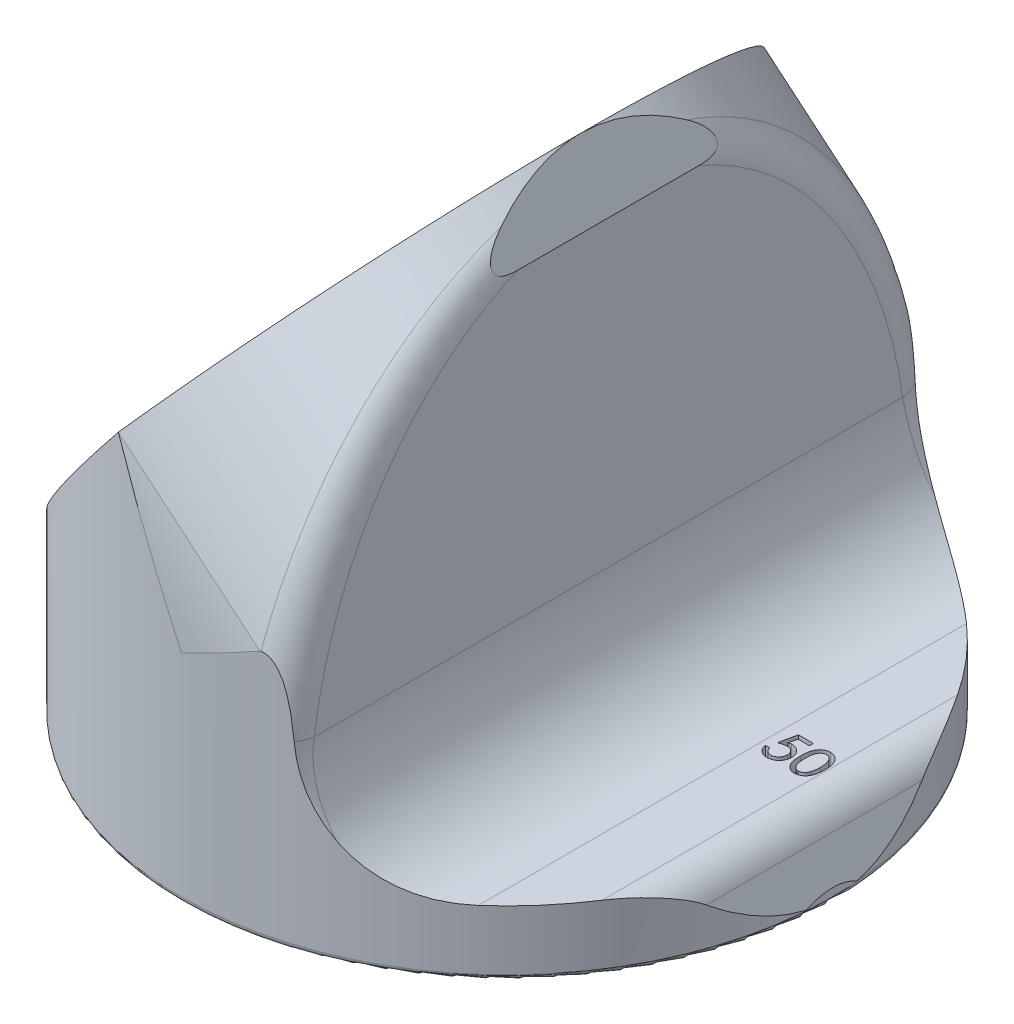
SolidWorks part; units mm, degrees
ref_plane "Front Plane" through (0, 0, 0) normal (0, 0, 1) x (1, 0, 0)
ref_plane "Top Plane" through (0, 0, 0) normal (0, 1, 0) x (1, 0, 0)
ref_plane "Right Plane" through (0, 0, 0) normal (1, 0, 0) x (0, 0, -1)
sketch "Sketch1" plane through (0, 0, 0) normal (0, 1, 0) x (1, 0, 0)
  circle A0 centre (0, 0) radius 30
extrude "Boss-Extrude1" add sketch "Sketch1" along normal blind 50
sketch "Sketch3" plane through (0, 50, 0) normal (0, 1, 0) x (1, 0, 0)
sketch "Sketch4" plane through (0, 0, 0) normal (0, -1, 0) x (-1, 0, 0)
  line L0 (0, 0) -> (-10, 0) construction
  line L1 (0, 0) -> (0, -10) construction
  line L2 (0, 0) -> (0, 10) construction
  line L3 (0, 0) -> (10, 0) construction
  line L5 (-2.5, 2.5) -> (2.5, 2.5)
  line L6 (-2.5, 2.5) -> (-2.5, -2.5)
  line L7 (-2.5, -2.5) -> (2.5, -2.5)
  line L8 (2.5, 2.5) -> (2.5, -2.5)
  line L9 (-2.5, 2.5) -> (2.5, -2.5) construction
  line L10 (-2.5, -2.5) -> (2.5, 2.5) construction
  line L11 (-2.5, -7.5) -> (2.5, -7.5)
  line L12 (-2.5, -7.5) -> (-2.5, -12.5)
  line L13 (-2.5, -12.5) -> (2.5, -12.5)
  line L14 (2.5, -7.5) -> (2.5, -12.5)
  line L15 (-2.5, -7.5) -> (2.5, -12.5) construction
  line L16 (-2.5, -12.5) -> (2.5, -7.5) construction
  line L17 (7.5, 2.5) -> (12.5, 2.5)
  line L18 (7.5, 2.5) -> (7.5, -2.5)
  line L19 (7.5, -2.5) -> (12.5, -2.5)
  line L20 (12.5, 2.5) -> (12.5, -2.5)
  line L21 (7.5, 2.5) -> (12.5, -2.5) construction
  line L22 (7.5, -2.5) -> (12.5, 2.5) construction
  line L23 (-12.5, 2.5) -> (-7.5, 2.5)
  line L24 (-12.5, 2.5) -> (-12.5, -2.5)
  line L25 (-12.5, -2.5) -> (-7.5, -2.5)
  line L26 (-7.5, 2.5) -> (-7.5, -2.5)
  line L27 (-12.5, 2.5) -> (-7.5, -2.5) construction
  line L28 (-12.5, -2.5) -> (-7.5, 2.5) construction
  line L29 (2.5, 7.5) -> (-2.5, 7.5)
  line L30 (2.5, 7.5) -> (2.5, 12.5)
  line L31 (2.5, 12.5) -> (-2.5, 12.5)
  line L32 (-2.5, 7.5) -> (-2.5, 12.5)
  line L33 (2.5, 7.5) -> (-2.5, 12.5) construction
  line L34 (2.5, 12.5) -> (-2.5, 7.5) construction
  dimension "D1" = 5
  dimension "D2" = 5
  dimension "D3" = 5
  dimension "D4" = 5
  dimension "D5" = 5
  dimension "D6" = 5
extrude "Cut-Extrude2" cut sketch "Sketch4" against normal blind 3
fillet "Fillet2" radius 0.5 21 edges at (0, 0, 30) (2.5, 0, 0) (0, 0, 2.5) (-2.5, 0, 0) (0, 0, -2.5) (2.5, 0, 10) (0, 0, 12.5) (-2.5, 0, 10) (0, 0, 7.5) (-7.5, 0, 0) (-10, 0, 2.5) (-12.5, 0, 0) (-10, 0, -2.5) (12.5, 0, 0) (10, 0, 2.5) (7.5, 0, 0) (10, 0, -2.5) (-2.5, 0, -10) (0, 0, -12.5) (2.5, 0, -10) (0, 0, -7.5)
ref_plane "Plane6" through (0, 0, 3.5) normal (0, 0, 1) x (1, 0, 0)
sketch "Sketch13" plane through (0, 0, 3.5) normal (0, 0, 1) x (1, 0, 0)
  line L0 (-30, 6) -> (6.9204, 50)
  line L1 (-30, 50) -> (-30, 0.5) construction
  line L4 (6.9204, 50) -> (-30, 50)
  line L5 (-30, 50) -> (-30, 6)
  line L6 (30, 0.5) -> (-30, 0.5) construction
  dimension "D1" = 5.5
  dimension "D2" = 50
extrude "Cut-Extrude10" cut sketch "Sketch13" against normal mid plane 90
ref_plane "Plane4" through (0, 0, -2.5) normal (0, 0, -1) x (-1, 0, 0)
ref_plane "Plane5" through (0, 0, -62.5) normal (0, 0, -1) x (-1, 0, 0)
sketch "Sketch15" plane through (-20.5591, 17.2512, 0) normal (-0.766, 0.6428, 0) x (0.6428, 0.766, 0)
  line L0 (-14.6874, 0) -> (0, 0) construction
  line L2 (7.8126, -2.5) -> (2.8126, -2.5)
  line L3 (7.8126, -2.5) -> (7.8126, 2.5)
  line L4 (7.8126, 2.5) -> (2.8126, 2.5)
  line L5 (2.8126, -2.5) -> (2.8126, 2.5)
  line L6 (7.8126, -2.5) -> (2.8126, 2.5) construction
  line L7 (7.8126, 2.5) -> (2.8126, -2.5) construction
  line L8 (17.8126, -2.5) -> (12.8126, -2.5)
  line L9 (17.8126, -2.5) -> (17.8126, 2.5)
  line L10 (17.8126, 2.5) -> (12.8126, 2.5)
  line L11 (12.8126, -2.5) -> (12.8126, 2.5)
  line L12 (17.8126, -2.5) -> (12.8126, 2.5) construction
  line L13 (17.8126, 2.5) -> (12.8126, -2.5) construction
  line L14 (27.8126, -2.5) -> (22.8126, -2.5)
  line L15 (27.8126, -2.5) -> (27.8126, 2.5)
  line L16 (27.8126, 2.5) -> (22.8126, 2.5)
  line L17 (22.8126, -2.5) -> (22.8126, 2.5)
  line L18 (27.8126, -2.5) -> (22.8126, 2.5) construction
  line L19 (27.8126, 2.5) -> (22.8126, -2.5) construction
  line L20 (17.8126, -12.5) -> (12.8126, -12.5)
  line L21 (17.8126, -12.5) -> (17.8126, -7.5)
  line L22 (17.8126, -7.5) -> (12.8126, -7.5)
  line L23 (12.8126, -12.5) -> (12.8126, -7.5)
  line L24 (17.8126, -12.5) -> (12.8126, -7.5) construction
  line L25 (17.8126, -7.5) -> (12.8126, -12.5) construction
  line L26 (17.8126, 7.5) -> (12.8126, 7.5)
  line L27 (17.8126, 7.5) -> (17.8126, 12.5)
  line L28 (17.8126, 12.5) -> (12.8126, 12.5)
  line L29 (12.8126, 7.5) -> (12.8126, 12.5)
  line L30 (17.8126, 7.5) -> (12.8126, 12.5) construction
  line L31 (17.8126, 12.5) -> (12.8126, 7.5) construction
  ellipse E0 centre (31.9844, 0) end of major axis (-14.6874, 0) minor radius 30 construction
  point P9 (5.3126, 0)
  point P14 (15.3126, 0)
  point P19 (25.3126, 0)
  point P24 (15.3126, -10)
  point P29 (15.3126, 10)
  dimension "D1" = 40
  dimension "D2" = 30
  dimension "D3" = 20
  dimension "D4" = 5
  dimension "D5" = 5
  dimension "D6" = 5
  dimension "D7" = 5
  dimension "D8" = 5
  dimension "D9" = 5
  dimension "D10" = 5
  dimension "D11" = 5
  dimension "D12" = 10
  dimension "D13" = 10
  dimension "D14" = 5
  dimension "D15" = 5
extrude "Cut-Extrude11" cut sketch "Sketch15" against normal blind 3
ref_plane "Plane7" through (0, 0, 0) normal (0, 0, -1) x (-1, 0, 0)
sketch "Sketch24" plane through (-20.5591, 17.2512, 0) normal (-0.766, 0.6428, 0) x (0.6428, 0.766, 0)
  line L0 (15.3126, -30) -> (8.2869, -61.3494)
  line L1 (15.3126, 0) -> (-14.6874, 0)
  line L3 (8.2869, -61.3494) -> (91.449, -58.1784)
  line L4 (91.449, -58.1784) -> (76.5573, 58.2179)
  line L5 (76.5573, 58.2179) -> (15.3126, 46.8115)
  line L6 (15.3126, 46.8115) -> (15.3126, 30)
  arc A0 (15.3126, -30) -> (-14.6874, 0) centre (15.3126, 0) ccw
  ellipse E1 centre (31.9844, 0) end of major axis (-14.6874, 0) minor radius 30 construction
  dimension "D1" = 30
extrude "Cut-Extrude13" cut sketch "Sketch24" against normal blind 100 contours A0 M21
fillet "Fillet8" radius 0.5 4 edges at (-10.7164, 28.9813, -7.5) (-9.1094, 30.8964, -10) (-10.7164, 28.9813, -12.5) (-12.3233, 27.0662, -10)
fillet "Fillet9" radius 0.5 4 edges at (-4.2885, 36.6418, 2.5) (-2.6815, 38.5569, 0) (-4.2885, 36.6418, -2.5) (-5.8955, 34.7267, 0)
fillet "Fillet10" radius 0.5 4 edges at (-18.7512, 19.4058, 0) (-17.1442, 21.3209, 2.5) (-15.5373, 23.236, 0) (-17.1442, 21.3209, -2.5)
fillet "Fillet11" radius 0.5 4 edges at (-12.3233, 27.0662, 10) (-10.7164, 28.9813, 12.5) (-9.1094, 30.8964, 10) (-10.7164, 28.9813, 7.5)
fillet "Fillet12" radius 0.5 4 edges at (-12.3233, 27.0662, 0) (-10.7164, 28.9813, 2.5) (-9.1094, 30.8964, 0) (-10.7164, 28.9813, -2.5)
sketch "Sketch26" plane through (0, 0, 3.5) normal (0, 0, 1) x (1, 0, 0)
  line L1 (21.1305, 54.6487) -> (36.0272, 54.6487)
  line L2 (21.1305, 54.6487) -> (21.1305, 40.5617)
  line L3 (21.1305, 40.5617) -> (36.0272, 40.5617)
  line L4 (36.0272, 54.6487) -> (36.0272, 40.5617)
  line L5 (21.1305, 54.6487) -> (36.0272, 40.5617) construction
  line L6 (21.1305, 40.5617) -> (36.0272, 54.6487) construction
  point P0 (28.5788, 47.6052)
extrude "Cut-Extrude14" cut sketch "Sketch26" against normal mid plane 100
sketch "Sketch30" plane through (-20.5591, 17.2512, 0) normal (-0.766, 0.6428, 0) x (0, 0, 1)
  line L0 (-29.2822, 21.8359) -> (-35.4469, 24.0158)
  line L1 (-35.4469, 24.0158) -> (-39.0994, 51.4803)
  line L2 (-39.0994, 51.4803) -> (38.7398, 54.3409)
  line L3 (38.7398, 54.3409) -> (35.5036, 17.2328)
  line L4 (35.5036, 17.2328) -> (29.2822, 21.8359)
  arc A0 (-29.2822, 21.8359) -> (29.2822, 21.8359) centre (0, 11.4818) cw
extrude "Cut-Extrude15" cut sketch "Sketch30" against normal blind 100
sketch "Sketch31" plane through (0, 0, 3.5) normal (0, 0, 1) x (1, 0, 0)
  line L0 (29.9083, 0.573) -> (6.7855, 49.8392)
  line L1 (6.7855, 49.8392) -> (36.2381, 46.7805)
  line L2 (36.2381, 46.7805) -> (29.9083, 0.573)
extrude "Cut-Extrude16" cut sketch "Sketch31" against normal mid plane 100
sketch "Sketch32" plane through (0, 0, 3.5) normal (0, 0, 1) x (1, 0, 0)
  line L0 (9.3497, 6) -> (27.3612, 6)
  line L1 (29.9083, 0.573) -> (18.131, 25.6662) construction
  line L2 (27.3612, 6) -> (9.3497, 44.3759)
  line L3 (18.131, 25.6662) -> (6.7855, 49.8392) construction
  line L4 (9.3497, 44.3759) -> (9.3497, 6)
extrude "Cut-Extrude17" cut sketch "Sketch32" against normal mid plane 100
fillet "Fillet13" radius 10.5 1 edges at (9.3497, 6, 0)
fillet "Fillet16" radius 3.5 1 edges at (27.3612, 6, 0)
fillet "Fillet17" radius 3.5 2 edges at (9.3497, 35.8312, -21.9476) (9.3497, 35.8312, 21.9476)
sketch "Sketch33" plane through (0, 6, 0) normal (0, 1, 0) x (1, 0, 0)
  text T0 "<b>50</b>"
extrude "Cut-Extrude18" cut sketch "Sketch33" against normal blind 2
